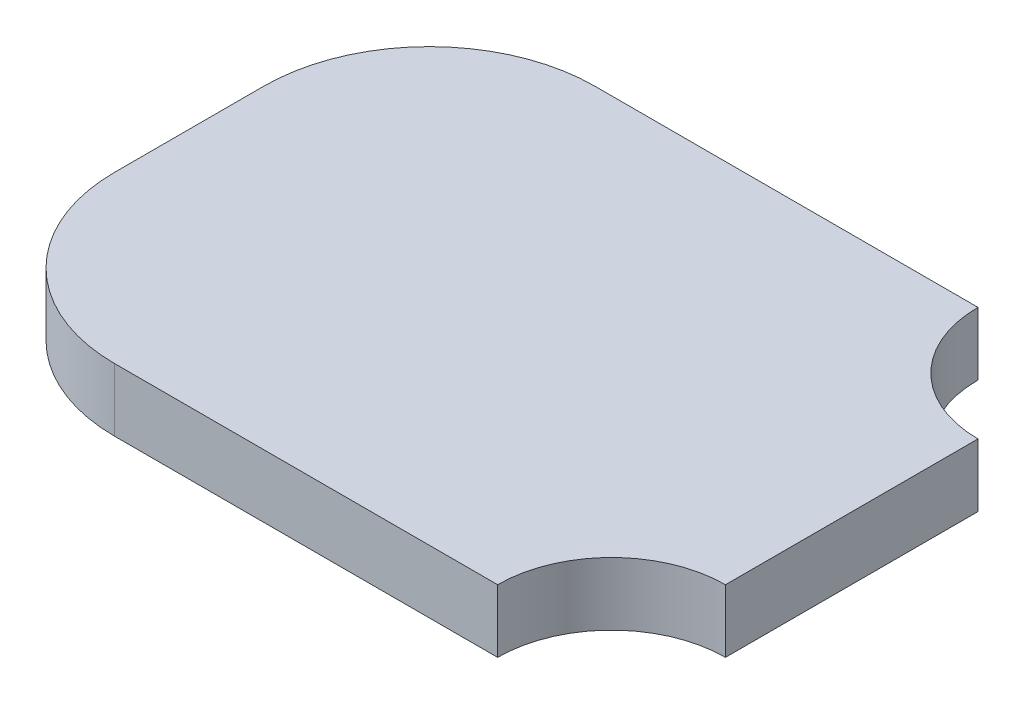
SolidWorks part; units mm, degrees
ref_plane "Front Plane" through (0, 0, 0) normal (0, 0, 1) x (1, 0, 0)
ref_plane "Top Plane" through (0, 0, 0) normal (0, 1, 0) x (1, 0, 0)
ref_plane "Right Plane" through (0, 0, 0) normal (1, 0, 0) x (0, 0, -1)
sketch "Sketch1"
  dimension "D3" = 25.4
  dimension "D1" = 73.66
  dimension "D2" = 101.6
extrude "Extrude1" add sketch "Sketch1" along normal blind 9.652
